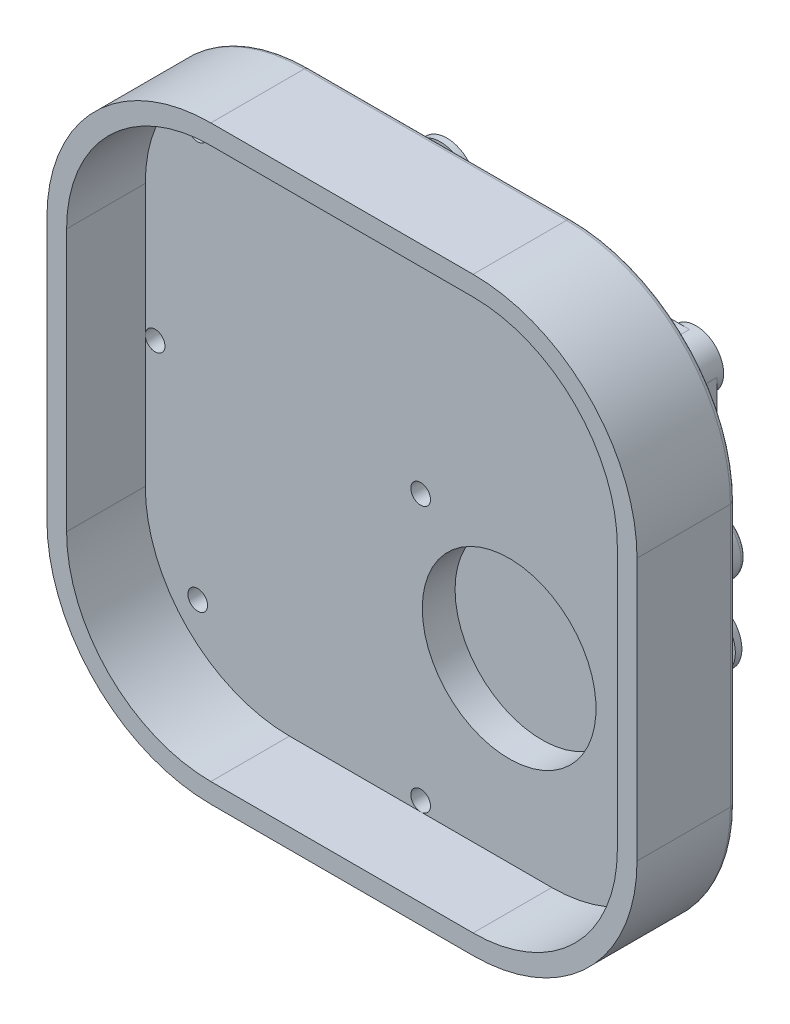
SolidWorks part; units mm, degrees
ref_plane "Plane1" through (0, 0, 0) normal (0, 0, 1) x (1, 0, 0)
ref_plane "Plane2" through (0, 0, 0) normal (0, 1, 0) x (1, 0, 0)
ref_plane "Plane3" through (0, 0, 0) normal (1, 0, 0) x (0, 0, -1)
sketch "Esquisse1" plane through (0, 0, 0) normal (0, 0, 1) x (1, 0, 0)
  line L0 (100, 360) -> (260, 360)
  line L1 (0, 260) -> (0, 100)
  line L2 (260, 0) -> (100, 0)
  line L3 (360, 100) -> (360, 260)
  arc A0 (100, 0) -> (0, 100) centre (100, 100) cw
  arc A1 (100, 360) -> (0, 260) centre (100, 260) ccw
  arc A2 (360, 260) -> (260, 360) centre (260, 260) ccw
  arc A3 (260, 0) -> (360, 100) centre (260, 100) ccw
  point P6 (0, 0)
  point P9 (0, 360)
  point P14 (360, 0)
  dimension "D3" = 100
  dimension "D1" = 360
  dimension "D2" = 360
extrude "Base-Extrusion" add sketch "Esquisse1" along normal blind 60
sketch "Esquisse5" plane through (0, 0, 0) normal (0, 0, -1) x (-1, 0, 0)
  circle A0 centre (-234, 120) radius 65
  dimension "D1" = 130
  dimension "D2" = 126
  dimension "D3" = 120
extrude "Boss.-Extru.3" add sketch "Esquisse5" along normal blind 20
shell "Coque3" thickness 12
sketch "Esquisse3" plane through (0, 0, 0) normal (0, 0, -1) x (-1, 0, 0)
  circle A0 centre (-316, 56) radius 16.8539
  dimension "D1" = 56
  dimension "D2" = 44
extrude "Boss.-Extru.1" add sketch "Esquisse3" along normal blind 20
pattern_linear "Répétition linéaire1" count 2 spacing 272 along (-1, 0, 0) count 2 spacing 248 along (0, 1, 0) of "Boss.-Extru.1"
sketch "Esquisse4" plane through (0, 0, 0) normal (0, 0, -1) x (-1, 0, 0)
  line L0 (-27.1461, 304) -> (-27.1461, 56)
  line L1 (-316, 320.8539) -> (-44, 320.8539)
  line L2 (-332.8539, 304) -> (-332.8539, 56)
  line L3 (-316, 39.1461) -> (-44, 39.1461)
  circle A9 centre (-316, 304) radius 16.8539 construction
  circle A10 centre (-44, 56) radius 16.8539 construction
  circle A11 centre (-316, 56) radius 16.8539 construction
  circle A12 centre (-44, 304) radius 16.8539 construction
  arc A13 (-316, 320.8539) -> (-332.8539, 304) centre (-316, 304) ccw
  arc A14 (-44, 39.1461) -> (-27.1461, 56) centre (-44, 56) ccw
  arc A15 (-332.8539, 56) -> (-316, 39.1461) centre (-316, 56) ccw
  arc A16 (-27.1461, 304) -> (-44, 320.8539) centre (-44, 304) ccw
extrude "Bos.-Extru.-Mince2" add sketch "Esquisse4" along normal blind 16 thin
sketch "Esquisse8"
  line L0 (-316, 304) -> (-44, 56)
extrude "Bos.-Extru.-Mince3" add sketch "Esquisse7" along normal blind 16 thin
sketch "Esquisse7" plane through (0, 0, 0) normal (0, 0, -1) x (-1, 0, 0)
  line L0 (-44, 304) -> (-191.6884, 169.3429)
extrude "Bos.-Extru.-Mince4" add sketch "Esquisse8" along normal blind 16 thin
sketch "Esquisse9" plane through (0, 0, 0) normal (0, 0, -1) x (-1, 0, 0)
  line L1 (-287.0306, 82.4133) -> (-316, 56)
extrude "Bos.-Extru.-Mince5" add sketch "Esquisse9" along normal blind 16 thin
fillet "Congé2" radius 3 16 edges at (0, 180, 0) (29.2893, 29.2893, 0) (32.0825, 315.9175, 0) (32.0825, 44.0825, 0) (327.9175, 315.9175, 0) (180, 0, 0) (327.9175, 44.0825, 0) (330.7107, 29.2893, 0) (360, 180, 0) (330.7107, 330.7107, 0) (180, 320.8539, 0) (27.1461, 180, 0) (180, 360, 0) (332.8539, 180, 0) (180, 39.1461, 0) (29.2893, 330.7107, 0)
sketch "Esquisse6" plane through (0, 0, -20) normal (0, 0, -1) x (-1, 0, 0)
  circle A0 centre (-234, 120) radius 18.5
  dimension "D1" = 37
extrude "Boss.-Extru.4" add sketch "Esquisse6" along normal blind 94
fillet "Congé3" radius 3 2 edges at (215.5, 120, -20) (215.5, 120, -114)
sketch "Esquisse12" plane through (0, 0, 0) normal (0, 0, -1) x (-1, 0, 0)
  circle A0 centre (-180, 180) radius 14
  dimension "D1" = 28
  dimension "D2" = 124
  dimension "D3" = 136
extrude "Boss.-Extru.6" add sketch "Esquisse12" along normal blind 20
sketch "Esquisse10" plane through (0, 0, 0) normal (0, 0, -1) x (-1, 0, 0)
  circle A0 centre (-342, 180) radius 18
  dimension "D3" = 36
  dimension "D1" = 180
  dimension "D2" = 18
extrude "Boss.-Extru.5" add sketch "Esquisse10" along normal blind 4
sketch "Esquisse11" plane through (0, 0, -4) normal (0, 0, -1) x (-1, 0, 0)
  circle A0 centre (-342, 180) radius 6
  dimension "D1" = 12
extrude "Enlèv. mat.-Extru.2" cut sketch "Esquisse11" against normal through all
pattern_circular "Répétition circulaire3" count 4 every 90 about axis through (180, 180, 0) along (0, 0, 1) of "Enlèv. mat.-Extru.2", "Boss.-Extru.5"
sketch "Esquisse13" plane through (0, 0, -20) normal (0, 0, -1) x (-1, 0, 0)
  circle A0 centre (-44, 56) radius 6
  dimension "D1" = 12
extrude "Enlèv. mat.-Extru.3" cut sketch "Esquisse13" against normal through all
pattern_linear "Répétition linéaire7" count 2 spacing 248 along (0, 1, 0) of "Enlèv. mat.-Extru.3"
sketch "Esquisse14" plane through (0, 0, -20) normal (0, 0, -1) x (-1, 0, 0)
  circle A0 centre (-180, 180) radius 6
  dimension "D1" = 12
extrude "Enlèv. mat.-Extru.4" cut sketch "Esquisse14" against normal through all
